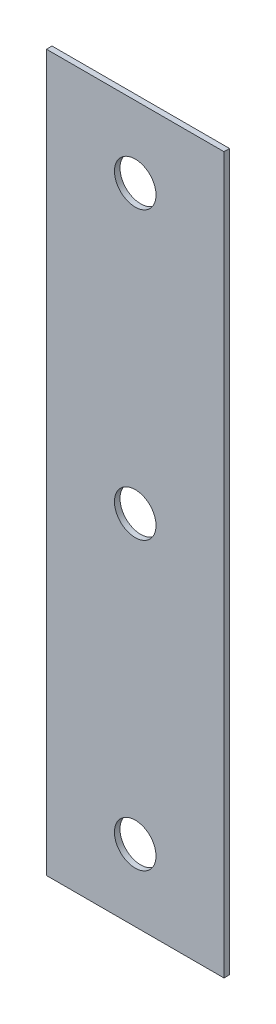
SolidWorks part; units mm, degrees
ref_plane "Front Plane" through (0, 0, 0) normal (0, 0, 1) x (1, 0, 0)
ref_plane "Top Plane" through (0, 0, 0) normal (0, 1, 0) x (1, 0, 0)
ref_plane "Right Plane" through (0, 0, 0) normal (1, 0, 0) x (0, 0, -1)
sketch "Sketch2" plane through (0, 0, 0) normal (0, 1, 0) x (1, 0, 0)
  circle A0 centre (0, 0) radius 0.85
extrude "Boss-Extrude1" add sketch "Sketch2" along normal blind 64.5
sketch "Sketch6" plane through (0, 0, 0) normal (0, -1, 0) x (-1, 0, 0)
  line L1 (0, -0.85) -> (-16, -0.85)
  line L2 (0, -0.85) -> (0, -1.35)
  line L3 (0, -1.35) -> (-16, -1.35)
  line L4 (-16, -0.85) -> (-16, -1.35)
  circle A0 centre (0, 0) radius 0.85 construction
  dimension "D1" = 16
  dimension "D2" = 0.5
sketch "Sketch7" plane through (0, 0, 0) normal (0, 0, 1) x (1, 0, 0)
  line L0 (-0.0448, 12.9) -> (-0.0448, 25.8) construction
  line L1 (-1.4209, 0) -> (1.3313, 0)
  line L2 (-1.4209, 0) -> (-1.4209, 12.9)
  line L3 (-1.4209, 12.9) -> (1.3313, 12.9)
  line L4 (1.3313, 0) -> (1.3313, 12.9)
  line L5 (-0.0448, 38.7421) -> (-0.0448, 51.6421) construction
  line L6 (-1.5227, 25.8421) -> (1.4331, 25.8421)
  line L7 (-1.5227, 25.8421) -> (-1.5227, 38.7421)
  line L8 (-1.5227, 38.7421) -> (1.4331, 38.7421)
  line L9 (1.4331, 25.8421) -> (1.4331, 38.7421)
  line L10 (0, 0) -> (16, 0) construction
  line L11 (-1.5227, 51.6421) -> (1.4331, 51.6421)
  line L12 (-1.5227, 51.6421) -> (-1.5227, 64.5421)
  line L13 (-1.5227, 64.5421) -> (1.4331, 64.5421)
  line L14 (1.4331, 51.6421) -> (1.4331, 64.5421)
  point P16 (1.3313, 0)
  dimension "D1" = 12.9
  dimension "D2" = 12.9
  dimension "D3" = 12.9
  dimension "D4" = 12.9
  dimension "D5" = 12.9
extrude "Cut-Extrude3" cut sketch "Sketch7" against normal up to next and the other way up to next
extrude "Boss-Extrude3" add sketch "Sketch6" against normal blind 64.5 separate body contours L1 L4 L3 L2
sketch "Sketch8" plane through (0, 0, 0.85) normal (0, 0, -1) x (-1, 0, 0)
  line L0 (0, 0) -> (0, 12.9) construction
  line L1 (0, 64.5) -> (0, 0) construction
  line L2 (0, 6.45) -> (-16, 6.45) construction
  line L3 (-16, 64.5) -> (-16, 0) construction
  line L4 (0, 32.25) -> (-16, 32.25) construction
  line L5 (0, 64.5) -> (0, 51.6) construction
  line L6 (0, 58.05) -> (-16, 58.05) construction
  circle A0 centre (-8, 32.25) radius 1.875
  circle A1 centre (-8, 6.45) radius 1.875
  circle A2 centre (-8, 58.05) radius 1.875
  dimension "D1" = 3.75
extrude "Cut-Extrude4" cut sketch "Sketch8" against normal up to next (0.5 mm away)
